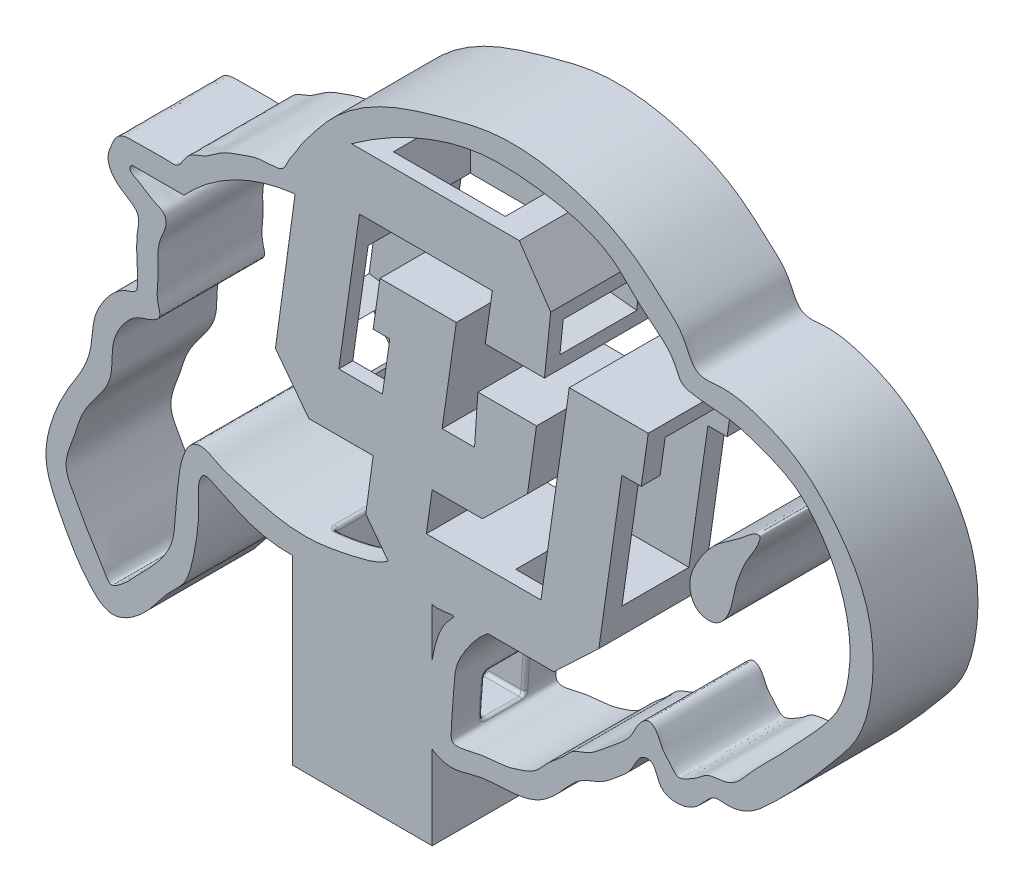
SolidWorks part; units mm, degrees
ref_plane "Front Plane" through (0, 0, 0) normal (0, 0, 1) x (1, 0, 0)
ref_plane "Top Plane" through (0, 0, 0) normal (0, 1, 0) x (1, 0, 0)
ref_plane "Right Plane" through (0, 0, 0) normal (1, 0, 0) x (0, 0, -1)
sketch "Sketch1" plane through (0, 0, 0) normal (0, 0, 1) x (1, 0, 0)
  line L0 (-34.6272, 39.8486) -> (140.0394, 39.8486) construction
sketch "Sketch2" plane through (0, 0, 0) normal (0, 0, 1) x (1, 0, 0)
  line L0 (-31.548, 27.0409) -> (-35.1224, 0.9367)
  line L1 (-35.1224, 0.9367) -> (-29.0428, -7.0721)
  line L2 (-29.0428, -7.0721) -> (-17.3586, -7.0721)
  line L3 (-17.3586, -7.0721) -> (-18.7082, -16.9287)
  line L4 (-18.7082, -16.9287) -> (-14.6259, -22.3064)
  line L5 (-19.8556, 29.723) -> (-23.607, 3.4631)
  line L6 (-23.607, 3.4631) -> (-15.6713, 3.4631)
  line L7 (-15.6713, 3.4631) -> (-14.3323, 12.8359)
  line L8 (-14.3323, 12.8359) -> (-17.3586, 12.8359)
  line L9 (-17.3586, 12.8359) -> (-16.1265, 21.4607)
  line L10 (-16.1265, 21.4607) -> (-2.2528, 21.4607)
  line L11 (-2.2528, 21.4607) -> (-4.8247, 3.457)
  line L12 (-4.8247, 3.457) -> (1.068, 3.457)
  line L13 (1.068, 3.457) -> (1.6717, 12.4589)
  line L14 (1.6717, 12.4589) -> (12.3273, 12.4589)
  line L15 (12.3273, 12.4589) -> (10.6812, 0.9367)
  line L16 (10.6812, 0.9367) -> (2.4844, -7.0721)
  line L17 (2.4844, -7.0721) -> (-6.6361, -7.0721)
  line L18 (-6.6361, -7.0721) -> (-7.7026, -14.5377)
  line L19 (-7.7026, -14.5377) -> (13.14, -14.5377)
  line L20 (13.14, -14.5377) -> (18.2826, 21.4607)
  line L21 (18.2826, 21.4607) -> (32.6451, 21.4607)
  line L22 (32.6451, 21.4607) -> (31.3591, 12.4589)
  line L23 (31.3591, 12.4589) -> (27.8591, 12.4589)
  line L24 (27.8591, 12.4589) -> (23.6609, -16.9287)
  line L25 (23.6609, -16.9287) -> (15.4789, -24.6644)
  line L26 (15.4789, -24.6644) -> (3.4788, -24.6644)
  line L27 (-51.7651, 16.7311) -> (-61.0758, 16.7311)
  line L28 (-19.8556, 29.723) -> (4.2918, 29.723)
  line L29 (4.2918, 29.723) -> (3.0042, 20.7097)
  line L30 (3.0042, 20.7097) -> (13.7738, 20.7097)
  line L31 (13.7738, 20.7097) -> (14.9162, 31.6686)
  line L32 (14.9162, 31.6686) -> (9.2041, 40.0653)
  line L33 (9.2041, 40.0653) -> (-21.2981, 40.0653)
  spline S0 degree 2 poles (-31.548, 27.0409) (-43.4735, 25.6283) (-51.7651, 16.7311) knots 0 0 0 1 1 1
  spline S1 degree 3 poles (-61.0758, 16.7311) (-61.3898, 16.6743) (-61.9391, 15.6729) (-59.382, 14.6002) (-57.8393, 13.1177) (-55.3324, 12.3566) (-54.77, 10.296) (-55.8403, 8.4115) (-56.6999, 5.5095) (-56.1442, 1.7102) (-56.9926, -1.7168) (-55.8474, -4.5099) (-57.5954, -6.0779) (-60.4287, -6.4023) (-63.1774, -9.3227) (-65.0927, -13.2466) (-64.6302, -16.9973) (-65.7843, -20.7533) (-68.2241, -23.6514) (-70.5224, -27.1149) (-71.4045, -30.5573) (-72.6718, -33.4553) (-73.6467, -37.1973) (-71.3259, -41.0283) (-69.3888, -44.7203) (-67.503, -47.6335) (-66.3846, -49.359) (-65.8254, -50.4596) (-65.1145, -51.5255) (-62.6639, -50.0228) (-60.4234, -47.4708) (-56.6516, -43.7876) (-53.7808, -39.7104) (-53.2263, -34.3657) (-52.9494, -29.3873) (-52.2068, -24.6608) (-50.6436, -21.6175) (-48.07, -20.9835) (-45.3899, -22.7528) (-41.9038, -23.7239) (-37.9148, -24.7586) (-33.378, -25.8785) (-27.4189, -26.0978) (-20.9168, -24.7237) (-16.453, -23.6385) (-14.6259, -22.3064) knots 0 0 0 0 0.005968 0.016688 0.041966 0.055561 0.062313 0.081124 0.096008 0.122067 0.154814 0.166608 0.173643 0.196887 0.221384 0.248931 0.281144 0.293398 0.325771 0.355053 0.374934 0.395397 0.41848 0.447335 0.479026 0.502386 0.516103 0.519215 0.527502 0.536477 0.566397 0.60058 0.639251 0.661756 0.705647 0.737836 0.758195 0.76699 0.786935 0.817508 0.83947 0.868408 0.910037 0.956036 1 1 1 1
  spline S2 degree 3 poles (-21.2981, 40.0653) (-17.1073, 43.0871) (-10.2419, 47.0312) (2.148, 50.9151) (13.9191, 50.2365) (25.7555, 47.1492) (31.091, 40.4543) (35.7243, 37.4282) (37.6727, 34.6431) (38.5172, 32.1501) (42.559, 31.1844) (47.5236, 31.4102) (53.8598, 29.1533) (59.3876, 26.8788) (64.0861, 21.709) (67.8008, 15.2077) (69.556, 7.6034) (69.1567, 0.8981) (67.7684, -4.2735) (64.4437, -8.8094) (60.7734, -12.7352) (56.1545, -17.7103) (52.1132, -21.4791) (49.3533, -24.9898) (47.2229, -26.4199) (45.1611, -26.6122) (43.1241, -26.9353) (41.6272, -28.3978) (39.9455, -29.2942) (37.9123, -30.322) (36.6903, -28.4856) (35.0342, -27.0917) (34.5212, -24.9576) (32.8474, -23.4119) (30.6587, -25.0411) (30.0224, -27.1553) (28.0771, -29.4834) (25.8883, -31.0095) (23.6596, -33.0542) (21.5197, -34.58) (18.8699, -35.1741) (16.983, -37.6072) (14.4129, -39.2708) (12.4972, -41.9193) (9.8022, -43.1054) (5.9272, -44.25) (2.3606, -43.9799) (-3.2129, -45.876) (-3.186, -43.1627) (-3.0283, -40.6849) (-2.6773, -36.8603) (-2.5542, -32.8694) (-0.297, -28.6749) (1.5943, -26.1262) (3.4788, -24.6644) knots 0 0 0 0 0.065153 0.099265 0.161991 0.212554 0.24612 0.267226 0.281285 0.288886 0.298251 0.328951 0.353258 0.381757 0.403185 0.439835 0.475412 0.499671 0.524225 0.541544 0.569937 0.592109 0.627159 0.639435 0.648338 0.658483 0.665253 0.673788 0.683513 0.69106 0.697447 0.707559 0.718678 0.724631 0.732096 0.74674 0.753229 0.769731 0.780258 0.791403 0.80256 0.813036 0.828813 0.84105 0.8531 0.865271 0.890424 0.907965 0.912165 0.921008 0.940627 0.960125 0.970301 1 1 1 1
  spline S3 degree 3 number of poles 105 (-29.9096, 36.0981) -> (-29.9096, 36.0981)
  spline S4 degree 3 poles (53.0495, 15.3714) (52.0566, 15.643) (48.8944, 12.6084) (44.7972, 10.5542) (41.4356, 5.8649) (39.6595, 1.5605) (41.1776, -2.4442) (45.3233, -2.7803) (48.0129, 1.1197) (48.1172, 5.032) (50.22, 9.6589) (50.2742, 10.0638) (52.6121, 13.5419) (53.0495, 15.3714) (52.0566, 15.643) (48.8944, 12.6084) knots -0.080875 -0.023719 -0.002372 0 0.072379 0.207671 0.334597 0.42839 0.50265 0.572574 0.649918 0.775473 0.847047 0.919125 0.976281 0.997628 1 1.072379 1.207671 1.334597 only from (52.7796, 15.4438) to (52.7796, 15.4438)
extrude "Boss-Extrude1" add sketch "Sketch2" along normal mid plane 19.05 contours S4 | S3 S1 L27 S0 L0 L1 L2 L3 L4 L33 S2 L26 L25 L24 L23 L22 L21 L20 L19 L18 L17 L16 L15 L14 L13 L12 L11 L10 L9 L8 L7 L6 L5 L28 L29 L30 L31 L32
sketch "Sketch3" plane through (0, 0, 0) normal (0, 0, 1) x (1, 0, 0)
  line L0 (-129.0731, -63.1181) -> (74.1269, -63.1181) construction
  line L1 (-19.7566, -63.1181) -> (-19.7566, -55.3988) construction
  line L2 (-32.041, -30.0981) -> (-32.041, -63.1181) construction
  line L3 (73.6135, 9.7291) -> (73.6135, -63.1181) construction
  line L4 (-32.041, -30.0981) -> (-32.041, -63.1181)
  line L5 (-32.041, -63.1181) -> (-6.6318, -63.1181)
  line L6 (-6.6318, -63.1181) -> (-6.6318, -25.1498)
  spline S0 degree 3 number of poles 105 (-29.9096, 36.0981) -> (-29.9096, 36.0981) construction
  spline S2 degree 3 poles (-32.041, -30.0981) (-29.9122, -30.0406) (-25.5838, -29.3865) (-19.9998, -28.6123) (-15.2703, -27.1053) (-12.6256, -25.3878) (-9.7649, -24.3385) (-7.8714, -24.9195) (-6.7532, -25.1296) (-6.6318, -25.1498) knots 0.379249 0.379249 0.379249 0.379249 0.392567 0.40666 0.41457 0.423417 0.42633 0.433451 0.434328 0.434328 0.434328 0.434328
  point P9 (16.2356, -63.1181)
  dimension "D1" = 33.02
  dimension "D2" = 12.2843
  dimension "D3" = 203.2
extrude "Boss-Extrude2" add sketch "Sketch3" along normal mid plane 19.05
sketch "Sketch4" plane through (0, -63.1181, 0) normal (0, -1, 0) x (1, 0, 0)
  line L8 (-10.4418, -5.715) -> (-10.4418, 5.715)
  line L9 (-28.231, -5.715) -> (-10.4418, -5.715)
  line L10 (-28.231, 5.715) -> (-28.231, -5.715)
  line L11 (-10.4418, 5.715) -> (-28.231, 5.715)
  line L12 (-10.4418, -5.715) -> (-10.4418, 5.715)
  line L13 (-28.231, -5.715) -> (-10.4418, -5.715)
  line L14 (-28.231, 5.715) -> (-28.231, -5.715)
  line L15 (-10.4418, 5.715) -> (-28.231, 5.715)
  dimension "D1" = 3.81
extrude "Cut-Extrude1" cut sketch "Sketch4" against normal blind 38.1
fillet "Fillet1" radius 0.635 15 edges at (-28.231, -25.884, 0) (-22.4074, -25.0181, 0) (-10.4418, -63.1181, 0) (-19.3364, -63.1181, -5.715) (-19.3364, -63.1181, 5.715) (-10.4418, -44.0681, -5.715) (-28.231, -44.5011, -5.715) (-10.4418, -44.0681, 5.715) (-28.231, -44.5011, 5.715) (-28.231, -63.1181, 0) (-16.4246, -25.0181, 5.715) (-16.4246, -25.0181, -5.715) (-10.4418, -25.0181, 0)
sketch "Sketch5" plane through (-10.4418, 0, 0) normal (-1, 0, 0) x (0, 0, 1)
  line L0 (5.08, -52.2102) -> (-5.08, -52.2102) construction
  line L1 (-3.81, -44.407) -> (3.81, -44.407)
  line L2 (-3.81, -44.407) -> (-3.81, -36.787)
  line L3 (-3.81, -36.787) -> (3.81, -36.787)
  line L4 (3.81, -44.407) -> (3.81, -36.787)
  line L5 (-3.81, -44.407) -> (3.81, -36.787) construction
  line L6 (-3.81, -36.787) -> (3.81, -44.407) construction
  line L7 (5.08, -62.4831) -> (5.08, -25.6531) construction
  line L8 (-5.08, -25.6531) -> (-5.08, -62.4831) construction
  point P0 (0, -40.597)
  point P11 (0, -52.2102)
  dimension "D1" = 7.62
  dimension "D2" = 7.62
extrude "Cut-Extrude2" cut sketch "Sketch5" against normal blind 10.16
fillet "Fillet2" radius 0.635 12 edges at (-3.1507, -44.407, 0) (-6.7963, -44.407, -3.81) (-2.7207, -36.787, 0) (-6.5813, -36.787, -3.81) (-6.5813, -36.787, 3.81) (-6.7963, -44.407, 3.81) (-10.4418, -40.597, 3.81) (-10.4418, -44.407, 0) (-10.4418, -40.597, -3.81) (-10.4418, -36.787, 0)
ref_plane "Plane1" through (0, 18.9207, 0) normal (0, 1, 0) x (1, 0, 0)
sketch "Sketch6" plane through (0, 18.9207, 0) normal (0, 1, 0) x (1, 0, 0)
  line L0 (25.4638, 9.525) -> (25.4638, -9.525) construction
  line L1 (13.14, -6.0913) -> (37.7877, -6.0913)
  line L2 (13.14, -6.0913) -> (13.14, 6.0913)
  line L3 (13.14, 6.0913) -> (37.7877, 6.0913)
  line L4 (37.7877, -6.0913) -> (37.7877, 6.0913)
  line L5 (13.14, -6.0913) -> (37.7877, 6.0913) construction
  line L6 (13.14, 6.0913) -> (37.7877, -6.0913) construction
  line L7 (18.2826, 9.525) -> (32.6451, 9.525) construction
  line L8 (18.2826, -9.525) -> (32.6451, -9.525) construction
  line L10 (13.14, -9.525) -> (13.14, 9.525) construction
  point P0 (25.4638, 0)
extrude "Cut-Extrude5" cut sketch "Sketch6" against normal blind 30.48
sketch "Sketch7" plane through (0, 40.0653, 0) normal (0, 1, 0) x (1, 0, 0)
  line L0 (9.2041, -9.525) -> (9.2041, 9.525) construction
  line L1 (-16.2181, -6.985) -> (4.1241, -6.985)
  line L2 (-16.2181, -6.985) -> (-16.2181, 6.985)
  line L3 (-16.2181, 6.985) -> (4.1241, 6.985)
  line L4 (4.1241, -6.985) -> (4.1241, 6.985)
  line L5 (-16.2181, -6.985) -> (4.1241, 6.985) construction
  line L6 (-16.2181, 6.985) -> (4.1241, -6.985) construction
  line L7 (9.2041, 0) -> (-6.047, 0) construction
  line L8 (9.2041, -9.525) -> (-21.2981, -9.525) construction
  point P0 (-6.047, 0)
  dimension "D1" = 5.08
  dimension "D2" = 5.08
  dimension "D3" = 2.54
extrude "Cut-Extrude6" cut sketch "Sketch7" against normal blind 12.7
sketch "Sketch8" plane through (-34.6019, 4.738, 0) normal (-0.9908, 0.1357, 0) x (0, 0, 1)
  line L0 (9.525, -3.8368) -> (-9.525, -3.8368) construction
  line L1 (-6.985, -0.0268) -> (6.985, -0.0268)
  line L2 (-6.985, -0.0268) -> (-6.985, 19.971)
  line L3 (-6.985, 19.971) -> (6.985, 19.971)
  line L4 (6.985, -0.0268) -> (6.985, 19.971)
  line L5 (-6.985, -0.0268) -> (6.985, 19.971) construction
  line L6 (-6.985, 19.971) -> (6.985, -0.0268) construction
  line L7 (9.525, 22.511) -> (9.525, -3.8368) construction
  line L8 (0, -3.8368) -> (0, 9.9721) construction
  point P0 (0, 9.9721)
  dimension "D1" = 3.81
  dimension "D2" = 2.54
  dimension "D3" = 2.54
extrude "Cut-Extrude7" cut sketch "Sketch8" against normal blind 15.24
sketch "Sketch9" plane through (-21.8309, -16.5724, 0) normal (-0.7965, -0.6046, 0) x (0, 0, 1)
  line L0 (9.525, -53.9254) -> (9.525, 54.4695) construction
  line L1 (-6.985, 13.1976) -> (6.985, 13.1976)
  line L2 (-6.985, 13.1976) -> (-6.985, 20.7125)
  line L3 (-6.985, 20.7125) -> (6.985, 20.7125)
  line L4 (6.985, 13.1976) -> (6.985, 20.7125)
  line L5 (-6.985, 13.1976) -> (6.985, 20.7125) construction
  line L6 (-6.985, 20.7125) -> (6.985, 13.1976) construction
  line L7 (-9.525, 54.4695) -> (-9.525, -53.9254) construction
  line L8 (9.525, 21.9825) -> (-9.525, 21.9825) construction
  line L9 (9.525, 11.9276) -> (-9.525, 11.9276) construction
  point P0 (0, 16.955)
  dimension "D1" = 2.54
  dimension "D2" = 2.54
  dimension "D3" = 1.27
  dimension "D4" = 1.27
extrude "Cut-Extrude8" cut sketch "Sketch9" against normal blind 15.24
sketch "Sketch10" plane through (0, -7.0721, 0) normal (0, -1, 0) x (1, 0, 0)
  line L0 (-32.041, 9.525) -> (-6.6318, 9.525) construction
  line L1 (-26.5028, -6.985) -> (-19.8986, -6.985)
  line L2 (-26.5028, -6.985) -> (-26.5028, 6.985)
  line L3 (-26.5028, 6.985) -> (-19.8986, 6.985)
  line L4 (-19.8986, -6.985) -> (-19.8986, 6.985)
  line L5 (-26.5028, -6.985) -> (-19.8986, 6.985) construction
  line L6 (-26.5028, 6.985) -> (-19.8986, -6.985) construction
  line L7 (-32.041, -9.525) -> (-6.6318, -9.525) construction
  line L8 (-29.0428, 9.525) -> (-29.0428, -9.525) construction
  line L9 (-17.3586, 9.525) -> (-17.3586, -9.525) construction
  point P0 (-23.2007, 0)
  dimension "D1" = 2.54
  dimension "D2" = 2.54
  dimension "D3" = 2.54
  dimension "D4" = 2.54
extrude "Cut-Extrude9" cut sketch "Sketch10" against normal blind 15.24
sketch "Sketch11" plane through (11.49, -1.1978, 0) normal (0.9946, -0.1037, 0) x (0, 0, -1)
  line L0 (-9.525, 55.4521) -> (-9.525, -62.1466) construction
  line L1 (-6.985, 24.5662) -> (6.985, 24.5662)
  line L2 (-6.985, 24.5662) -> (-6.985, 30.5045)
  line L3 (-6.985, 30.5045) -> (6.985, 30.5045)
  line L4 (6.985, 24.5662) -> (6.985, 30.5045)
  line L5 (-6.985, 24.5662) -> (6.985, 30.5045) construction
  line L6 (-6.985, 30.5045) -> (6.985, 24.5662) construction
  line L7 (9.525, -45.1641) -> (9.525, 51.0241) construction
  line L8 (-9.525, 33.0445) -> (9.525, 33.0445) construction
  line L9 (-9.525, 22.0262) -> (9.525, 22.0262) construction
  point P0 (0, 27.5354)
  dimension "D1" = 2.54
  dimension "D2" = 2.54
  dimension "D3" = 2.54
  dimension "D4" = 2.54
extrude "Cut-Extrude10" cut sketch "Sketch11" against normal blind 15.24
sketch "Sketch12" plane through (0, -24.6644, 0) normal (0, -1, 0) x (1, 0, 0)
  line L0 (15.4789, 9.525) -> (3.4788, 9.525) construction
  line L1 (6.0188, -6.985) -> (12.9389, -6.985)
  line L2 (6.0188, -6.985) -> (6.0188, 6.985)
  line L3 (6.0188, 6.985) -> (12.9389, 6.985)
  line L4 (12.9389, -6.985) -> (12.9389, 6.985)
  line L5 (6.0188, -6.985) -> (12.9389, 6.985) construction
  line L6 (6.0188, 6.985) -> (12.9389, -6.985) construction
  line L7 (3.4788, 9.525) -> (3.4788, -9.525) construction
  line L8 (15.4789, 9.525) -> (15.4789, -9.525) construction
  point P0 (9.4789, 0)
  point P5 (0, 0)
  dimension "D1" = 2.54
  dimension "D2" = 2.54
  dimension "D3" = 2.54
extrude "Cut-Extrude11" cut sketch "Sketch12" against normal blind 15.24
